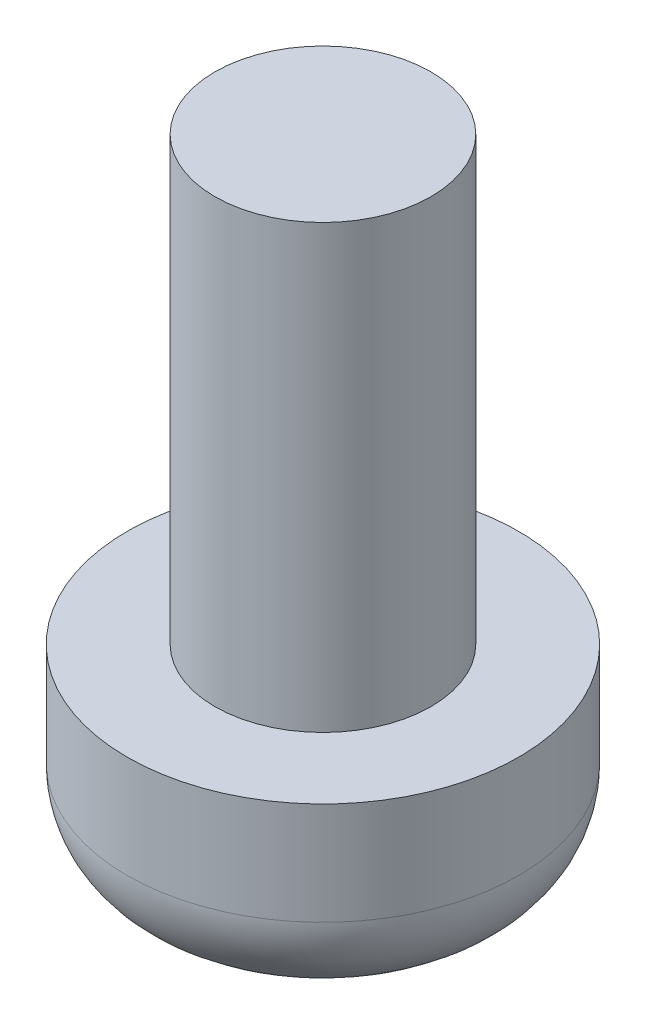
SolidWorks part; units mm, degrees
ref_plane "Front Plane" through (0, 0, 0) normal (0, 0, 1) x (1, 0, 0)
ref_plane "Top Plane" through (0, 0, 0) normal (0, 1, 0) x (1, 0, 0)
ref_plane "Right Plane" through (0, 0, 0) normal (1, 0, 0) x (0, 0, -1)
sketch "Sketch-Hex" plane through (0, 0, 0) normal (0, 1, 0) x (1, 0, 0)
  line L0 (0, 2.667) -> (0, -2.667) construction
  line L7 (-2.667, 0) -> (2.667, 0) construction
  circle A1 centre (0, 0) radius 2.667
  dimension "D1" = 5.334
extrude "Boss-Extrude1" add sketch "Sketch-Hex" along normal blind 2.667
sketch "Sketch3" plane through (0, 2.667, 0) normal (0, 1, 0) x (1, 0, 0)
  circle A0 centre (0, 0) radius 1.4732
  circle A2 centre (0, 0) radius 2.667 construction
  dimension "D1" = 2.9464
extrude "Boss-Extrude2" add sketch "Sketch3" along normal blind 6.0198
fillet "Fillet1" radius 1.27 1 edges at (0, 0, 2.667)
